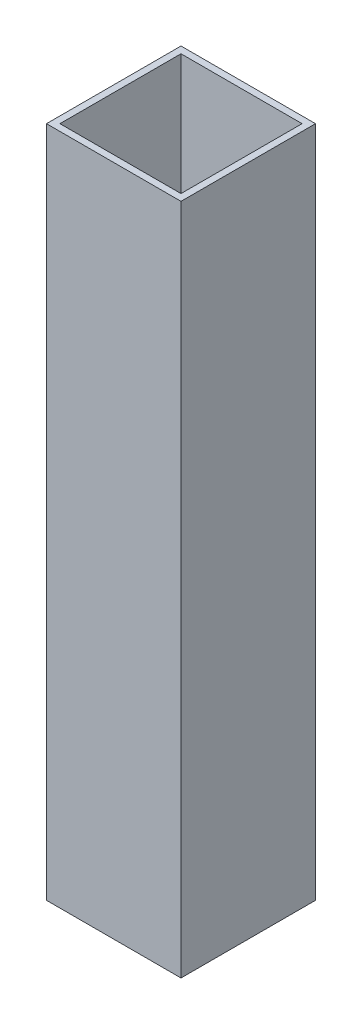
SolidWorks part; units mm, degrees
other "Trou"
ref_plane "Plan de face" through (0, 0, 0) normal (0, 0, 1) x (1, 0, 0)
ref_plane "Plan de dessus" through (0, 0, 0) normal (0, 1, 0) x (1, 0, 0)
ref_plane "Plan de droite" through (0, 0, 0) normal (1, 0, 0) x (0, 0, -1)
sketch "Esquisse1" plane through (0, 0, 0) normal (0, 1, 0) x (1, 0, 0)
  line L1 (-100, 100) -> (100, 100)
  line L2 (-100, 100) -> (-100, -100)
  line L3 (-100, -100) -> (100, -100)
  line L4 (100, 100) -> (100, -100)
  line L5 (-100, 100) -> (100, -100) construction
  line L6 (-100, -100) -> (100, 100) construction
  point P0 (0, 0)
  dimension "D1" = 200
  dimension "D2" = 200
extrude "Forme extérieure" add sketch "Esquisse1" along normal blind 1000
shell "Trou" thickness 10
equation "\"D2@Esquisse1\"=\"D1@Esquisse1\""
